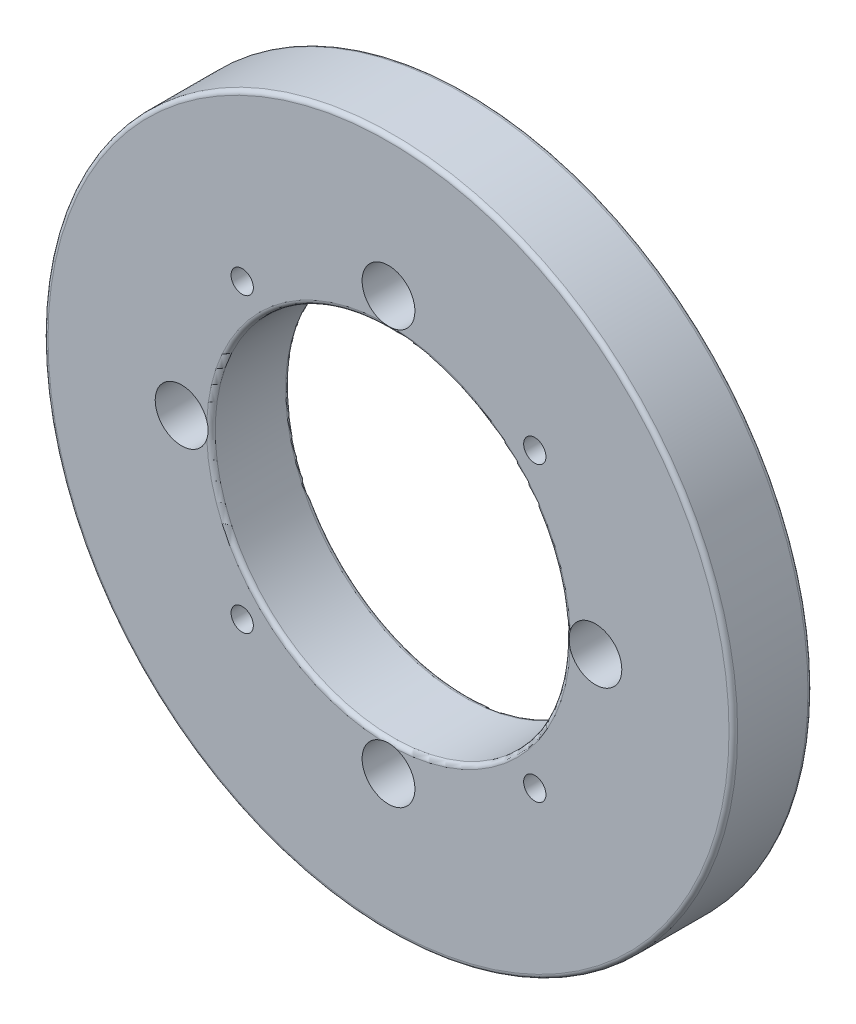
SolidWorks part; units mm, degrees
ref_plane "Front Plane" through (0, 0, 0) normal (0, 0, 1) x (1, 0, 0)
ref_plane "Top Plane" through (0, 0, 0) normal (0, 1, 0) x (1, 0, 0)
ref_plane "Right Plane" through (0, 0, 0) normal (1, 0, 0) x (0, 0, -1)
sketch "Sketch1" plane through (0, 0, 0) normal (0, 0, 1) x (1, 0, 0)
  circle A0 centre (0, 0) radius 127
  circle A1 centre (0, 0) radius 65.405
  dimension "D1" = 130.81
  dimension "D2" = 254
extrude "Boss-Extrude1" add sketch "Sketch1" along normal blind 29.0957
sketch "Sketch2" plane through (0, 0, 29.0957) normal (0, 0, 1) x (1, 0, 0)
  line L0 (55, 0) -> (-55, 0) construction
  line L1 (0, -55) -> (0, 55) construction
  circle A0 centre (0, 76.2) radius 9.7234
  dimension "D1" = 76.2
  dimension "D2" = 19.4469
extrude "Cut-Extrude1" cut sketch "Sketch2" against normal through all
pattern_circular "CirPattern1" count 4 over 360 of "Cut-Extrude1"
fillet "Fillet1" radius 1.5875
fillet "Fillet2" radius 1.5875
hole_wizard "1/4 Clearance Hole1" positions "Sketch3" profile "Sketch4" hole size "1/4" standard "ANSI Inch"
sketch "Sketch3" plane through (0, 0, 0) normal (0, 0, -1) x (-1, 0, 0)
  line L0 (-53.8815, -53.8815) -> (-53.8815, 53.8815)
  line L1 (-53.8815, 53.8815) -> (53.8815, 53.8815)
  line L2 (53.8815, 53.8815) -> (53.8815, -53.8815)
  line L3 (53.8815, -53.8815) -> (-53.8815, -53.8815)
  line L5 (16.0026, 0) -> (-16.0026, 0) construction
  line L7 (0, 16.0026) -> (0, -16.0026) construction
  point P0 (53.8815, 53.8815)
  point P2 (-53.8815, -53.8815)
  point P4 (53.8815, -53.8815)
  point P6 (-53.8815, 53.8815)
  point P21 (-53.8815, 0)
  point P22 (53.8815, 0)
  point P26 (0, 53.8815)
  dimension "D1" = 152.4
sketch "Sketch4" plane through (-53.8815, 53.8815, 0) normal (1, 0, 0) x (0, 1, 0)
  line L0 (0, 0) -> (0, 29.6113)
  line L1 (0, 29.6113) -> (4.1021, 29.6113)
  line L2 (4.1021, 29.6113) -> (4.1021, 0)
  line L5 (4.1021, 0) -> (0, 0)
  line L11 (0, -6.35) -> (0, 107.95) construction
  dimension "Thru Hole Dia." = 8.2042
  dimension "Thru Hole Depth" = 29.6113
